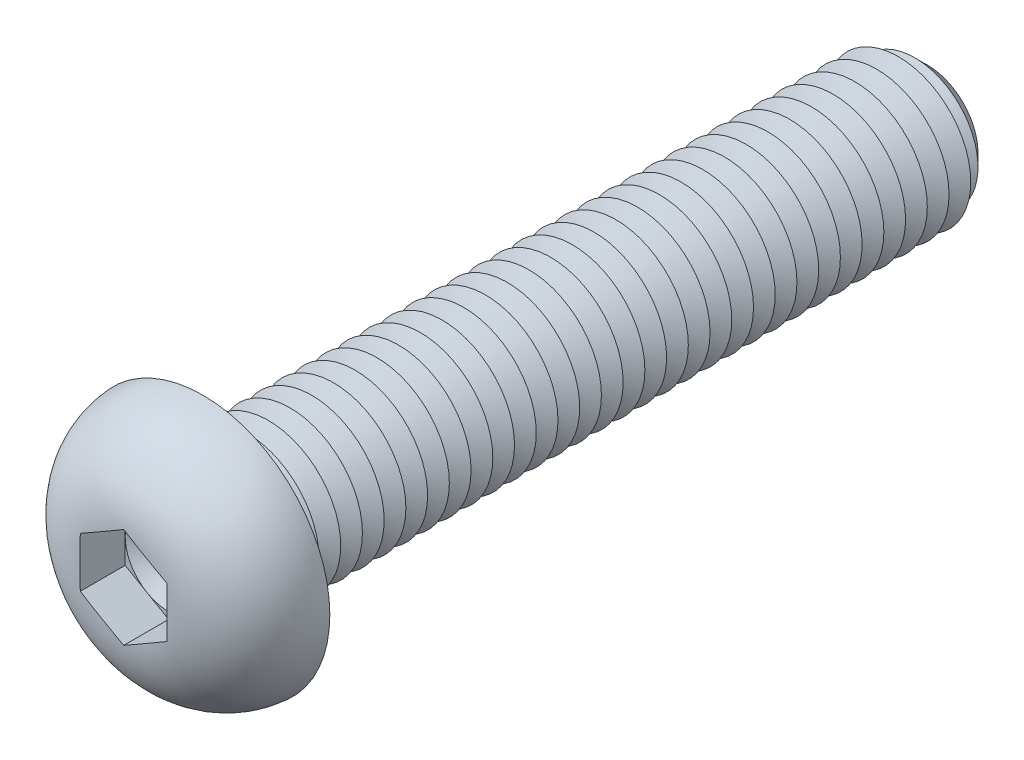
SolidWorks part; units mm, degrees
ref_plane "Front Plane" through (0, 0, 0) normal (0, 0, 1) x (1, 0, 0)
ref_plane "Top Plane" through (0, 0, 0) normal (0, 1, 0) x (1, 0, 0)
ref_plane "Right Plane" through (0, 0, 0) normal (1, 0, 0) x (0, 0, -1)
sketch "Sketch1" plane through (0, 0, 0) normal (1, 0, 0) x (0, 0, -1)
  line L0 (-47.9342, 0) -> (60.3146, 0) construction
sketch "Sketch2" plane through (0, 0, 0) normal (1, 0, 0) x (0, 0, -1)
  line L0 (0, 0) -> (-5.5, 0)
  line L1 (-47.9342, 0) -> (60.3146, 0) construction
  line L2 (-5.5, 0) -> (-5.5, 2.9578)
  line L3 (0, 8.75) -> (0, 0)
  arc A0 (-5.5, 2.9578) -> (0, 8.75) centre (0.3, 2.9578) cw
  dimension "D1" = 5.8
  dimension "D2" = 5.5
  dimension "D3" = 8.75
revolve "Revolve1" add sketch "Sketch2" angle 360 about L0
sketch "Sketch3" plane through (0, 0, 5.5) normal (0, 0, 1) x (1, 0, 0)
  line L1 (0, 3.4641) -> (-3, 1.7321)
  line L2 (-3, 1.7321) -> (-3, -1.7321)
  line L3 (-3, -1.7321) -> (0, -3.4641)
  line L4 (0, -3.4641) -> (3, -1.7321)
  line L5 (3, -1.7321) -> (3, 1.7321)
  line L6 (3, 1.7321) -> (0, 3.4641)
  circle A0 centre (0, 0) radius 3 construction
  dimension "D1" = 6
extrude "Cut-Extrude1" cut sketch "Sketch3" against normal blind 3.12
sketch "Sketch4" plane through (0, 0, 0) normal (0, 0, -1) x (-1, 0, 0)
  circle A0 centre (0, 0) radius 5
  dimension "D1" = 10
extrude "Boss-Extrude1" add sketch "Sketch4" along normal blind 50
chamfer "Chamfer1" distance 1.5 angle 45 1 edges at (-5, 0, -50)
sketch "Sketch5" plane through (0, 0, 0) normal (1, 0, 0) x (0, 0, -1)
  line L0 (1.5, 5) -> (3, 5)
  line L1 (48.5, 5) -> (0, 5) construction
  line L2 (3, 5) -> (2.25, 3.701)
  line L3 (2.25, 3.701) -> (1.5, 5)
  line L4 (0, -8.75) -> (0, 8.75) construction
  line L5 (48.5, 5) -> (0, 5) construction
  dimension "D1" = 1.5
  dimension "D2" = 1.5
revolve "Cut-Revolve1" cut sketch "Sketch5" angle 360 about L0
pattern_linear "LPattern1" count 32 spacing 1.5 along (0, 0, -1) of "Cut-Revolve1"
fillet "Fillet2" radius 0.6 1 edges at (5, 0, 0)
sketch "Sketch6" plane through (0, 0, 2.38) normal (0, 0, 1) x (1, 0, 0)
  line L0 (0, -3.4641) -> (3, -1.7321) construction
  circle A0 centre (0, 0) radius 3
extrude "Cut-Extrude2" cut sketch "Sketch6" against normal through all draft 60
